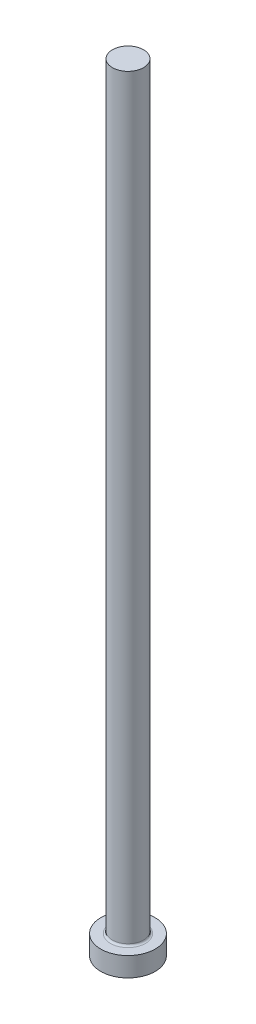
SolidWorks part; units mm, degrees
ref_plane "Plano frontal" through (0, 0, 0) normal (0, 0, 1) x (1, 0, 0)
ref_plane "Plano superior" through (0, 0, 0) normal (0, 1, 0) x (1, 0, 0)
ref_plane "Plano direito" through (0, 0, 0) normal (1, 0, 0) x (0, 0, -1)
sketch "Esboço1" plane through (0, 0, 0) normal (0, 0, 1) x (1, 0, 0)
  line L0 (0, 0) -> (7, 0)
  line L1 (7, 0) -> (7, 5)
  line L2 (7, 5) -> (4.5, 5)
  line L3 (4, 5.5) -> (4, 200)
  line L4 (4, 200) -> (0, 200)
  line L5 (0, 200) -> (0, 0) construction
  line L6 (0, 0) -> (0, 200)
  arc A0 (4.5, 5) -> (4, 5.5) centre (4.5, 5.5) cw
  dimension "D3" = 0.5
  dimension "D1" = 14
  dimension "D2" = 8
  dimension "D4" = 5
  dimension "D5" = 200
revolve "Revolução1" add sketch "Esboço1" angle 360 about L5
sketch "Esboço2"
  dimension "D1" = 0.525
  dimension "D2" = 1.225
  dimension "D3" = 0.7875
  dimension "D4" = 3.7625
wrap "Envolver1" sketch "Esboço2" source sketch "Esboço2" thickness 0.1 parameters "D1"=0.1
